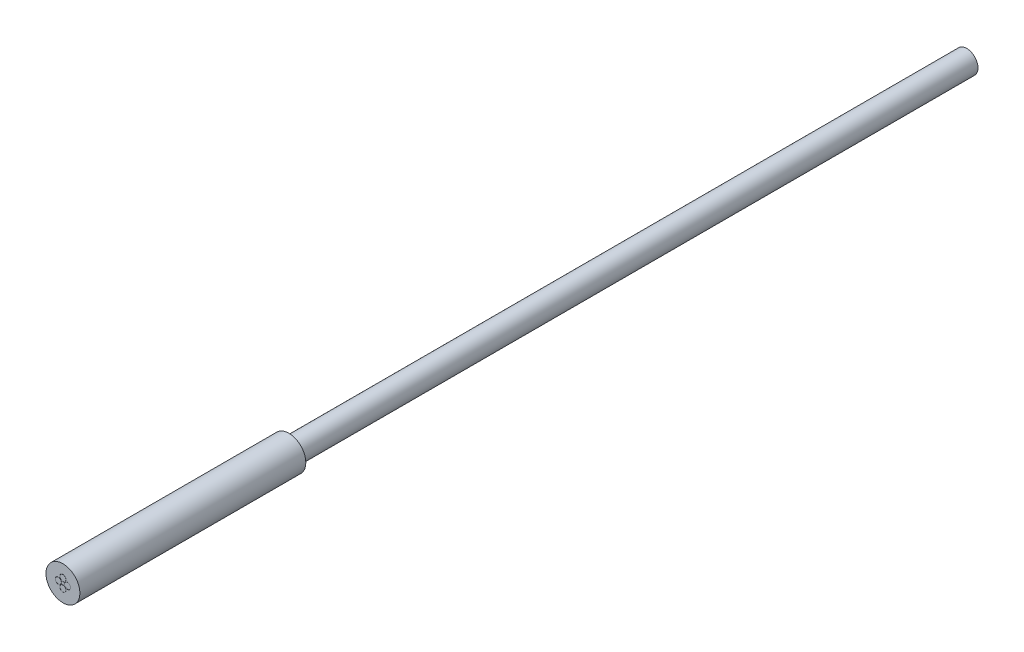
SolidWorks part; units mm, degrees
ref_plane "前视基准面" through (0, 0, 0) normal (0, 0, 1) x (1, 0, 0)
ref_plane "上视基准面" through (0, 0, 0) normal (0, 1, 0) x (1, 0, 0)
ref_plane "右视基准面" through (0, 0, 0) normal (1, 0, 0) x (0, 0, -1)
sketch "草图1" plane through (0, 0, 0) normal (0, 0, 1) x (1, 0, 0)
  circle A0 centre (0, 0) radius 0.75
  dimension "D1" = 1.5
extrude "凸台-拉伸1" add sketch "草图1" against normal blind 10
sketch "草图2" plane through (0, 0, -10) normal (0, 0, -1) x (-1, 0, 0)
  circle A0 centre (0, 0) radius 0.5
  dimension "D1" = 1
extrude "凸台-拉伸2" add sketch "草图2" along normal blind 30
sketch "草图3" plane through (0, 0, 0) normal (0, 0, 1) x (1, 0, 0)
  circle A0 centre (0, 0) radius 0.339 construction
  circle A1 centre (0, 0.2015) radius 0.1375
  circle A2 centre (0.2015, 0) radius 0.1375
  circle A3 centre (0, -0.2015) radius 0.1375
  circle A4 centre (-0.2015, 0) radius 0.1375
  circle A5 centre (-0.2015, 0) radius 0.1325
  circle A6 centre (0, 0.2015) radius 0.1325
  circle A7 centre (0.2015, 0) radius 0.1325
  circle A8 centre (0, -0.2015) radius 0.1325
  dimension "D1" = 0.265
  dimension "D2" = 0.275
  dimension "D3" = 0.01
extrude "切除-拉伸1" cut sketch "草图3" against normal blind 0.1
